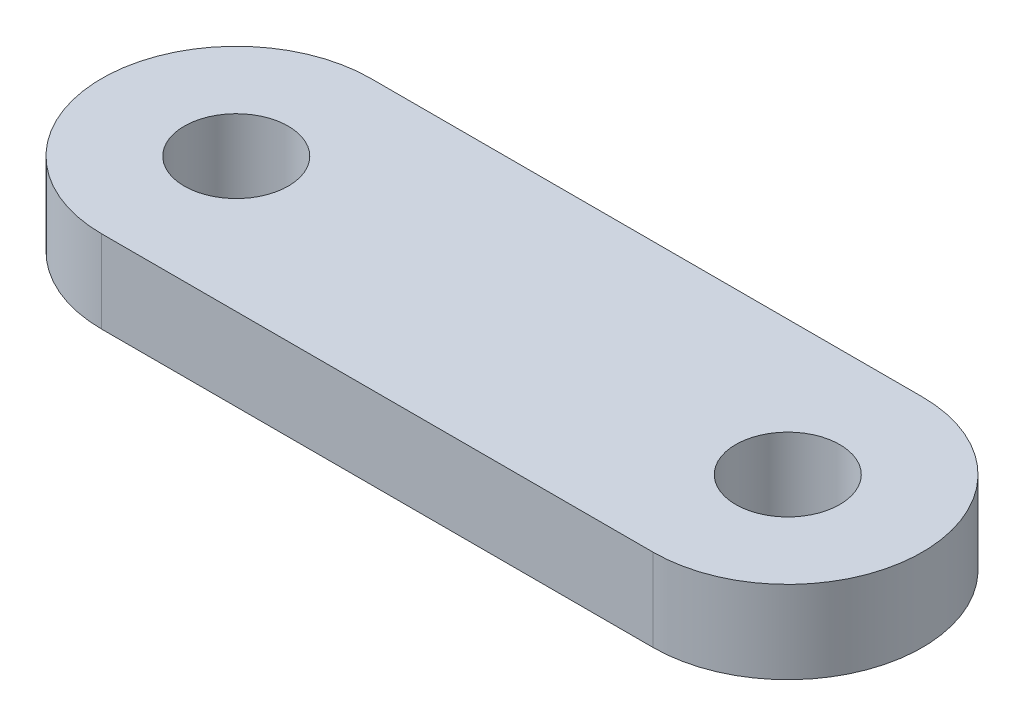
SolidWorks part; units mm, degrees
ref_plane "Front Plane" through (0, 0, 0) normal (0, 0, 1) x (1, 0, 0)
ref_plane "Top Plane" through (0, 0, 0) normal (0, 1, 0) x (1, 0, 0)
ref_plane "Right Plane" through (0, 0, 0) normal (1, 0, 0) x (0, 0, -1)
sketch "Sketch1" plane through (0, 0, 0) normal (0, 1, 0) x (1, 0, 0)
  line L1 (-10.6045, 0) -> (10.6045, 0) construction
  line L2 (-10.6045, 5.175) -> (10.6045, 5.175)
  line L3 (-10.6045, -5.175) -> (10.6045, -5.175)
  arc A0 (-10.6045, 5.175) -> (-10.6045, -5.175) centre (-10.6045, 0) ccw
  arc A1 (10.6045, -5.175) -> (10.6045, 5.175) centre (10.6045, 0) ccw
  circle A2 centre (-10.6045, 0) radius 2
  circle A3 centre (10.6045, 0) radius 2
  point P0 (0, 0)
  point P4 (0, 0)
  point P13 (-11.938, 4.7427)
  dimension "D2" = 4
  dimension "D3" = 3.175
  dimension "D1" = 21.209
extrude "Boss-Extrude1" add sketch "Sketch1" along normal mid plane 3.175
